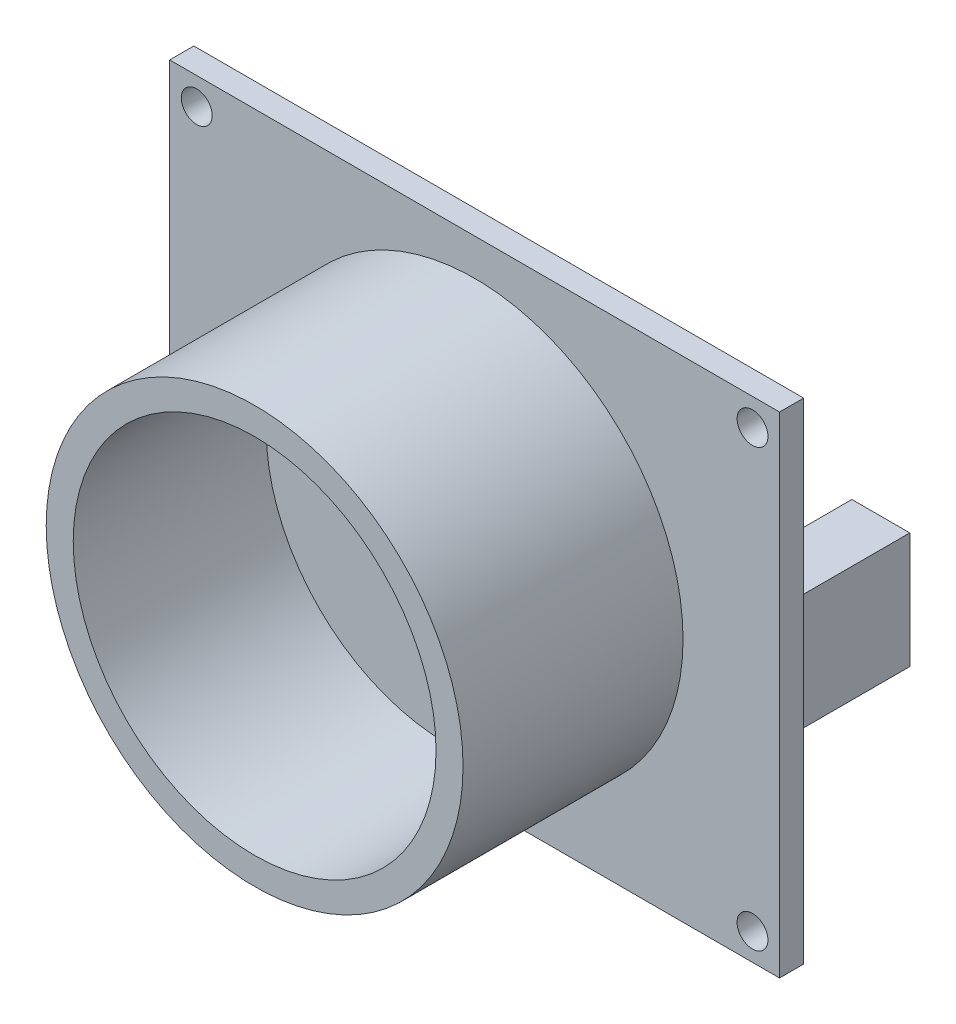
SolidWorks part; units mm, degrees
ref_plane "Front Plane" through (0, 0, 0) normal (0, 0, 1) x (1, 0, 0)
ref_plane "Top Plane" through (0, 0, 0) normal (0, 1, 0) x (1, 0, 0)
ref_plane "Right Plane" through (0, 0, 0) normal (1, 0, 0) x (0, 0, -1)
sketch "Sketch1" plane through (0, 0, 0) normal (0, 0, 1) x (1, 0, 0)
  line L1 (-20.066, -16.129) -> (20.066, -16.129)
  line L2 (-20.066, -16.129) -> (-20.066, 16.129)
  line L3 (-20.066, 16.129) -> (20.066, 16.129)
  line L4 (20.066, -16.129) -> (20.066, 16.129)
  line L5 (-20.066, -16.129) -> (20.066, 16.129) construction
  line L6 (-20.066, 16.129) -> (20.066, -16.129) construction
  point P0 (0, 0)
  dimension "D1" = 40.132
  dimension "D2" = 32.258
extrude "pcb" add sketch "Sketch1" along normal blind 1.5875
sketch "Sketch2" plane through (0, 0, 1.5875) normal (0, 0, 1) x (1, 0, 0)
  line L0 (20.066, 0) -> (0, 0) construction
  line L1 (20.066, -16.129) -> (20.066, 16.129) construction
  line L2 (0, 0) -> (0, 16.129) construction
  line L3 (20.066, 16.129) -> (-20.066, 16.129) construction
  circle A0 centre (18.288, 14.351) radius 1.016
  circle A1 centre (18.288, -14.351) radius 1.016
  circle A2 centre (-18.288, -14.351) radius 1.016
  circle A3 centre (-18.288, 14.351) radius 1.016
  dimension "D1" = 2.032
  dimension "D2" = 1.778
  dimension "D3" = 1.778
extrude "mount_holes" cut sketch "Sketch2" against normal blind 1.5875
sketch "Sketch3" plane through (0, 0, 1.5875) normal (0, 0, 1) x (1, 0, 0)
  circle A0 centre (0, 0) radius 13.716
  dimension "D1" = 27.432
extrude "lens_mount" add sketch "Sketch3" along normal blind 14.478
sketch "Sketch5" plane through (0, 0, 16.0655) normal (0, 0, 1) x (1, 0, 0)
  circle A0 centre (0, 0) radius 11.938
  dimension "D1" = 23.876
extrude "mount_id" cut sketch "Sketch5" against normal blind 12.7
sketch "Sketch4" plane through (0, 0, 0) normal (0, 0, -1) x (-1, 0, 0)
  line L0 (-20.066, 0) -> (-17.018, 0) construction
  line L1 (-20.066, -16.129) -> (-20.066, 16.129) construction
  line L3 (-18.923, -3.81) -> (-15.113, -3.81)
  line L4 (-18.923, -3.81) -> (-18.923, 3.81)
  line L5 (-18.923, 3.81) -> (-15.113, 3.81)
  line L6 (-15.113, -3.81) -> (-15.113, 3.81)
  line L7 (-18.923, -3.81) -> (-15.113, 3.81) construction
  line L8 (-18.923, 3.81) -> (-15.113, -3.81) construction
  dimension "D1" = 3.048
  dimension "D2" = 3.81
  dimension "D3" = 7.62
extrude "usb" add sketch "Sketch4" along normal blind 8.128
